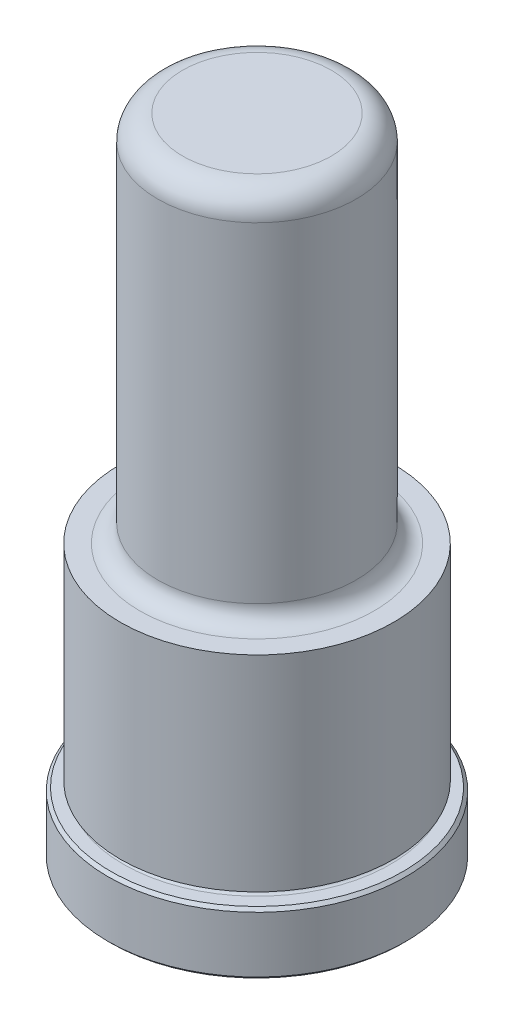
SolidWorks part; units mm, degrees
ref_plane "Front Plane" through (0, 0, 0) normal (0, 0, 1) x (1, 0, 0)
ref_plane "Top Plane" through (0, 0, 0) normal (0, 1, 0) x (1, 0, 0)
ref_plane "Right Plane" through (0, 0, 0) normal (1, 0, 0) x (0, 0, -1)
sketch "Sketch1" plane through (0, 0, 0) normal (1, 0, 0) x (0, 0, -1)
  line L0 (0, 0) -> (19.05, 0)
  line L1 (19.05, 0) -> (19.05, 7.9248)
  line L2 (19.05, 7.9248) -> (17.0688, 7.9248)
  line L3 (16.6878, 2.6782) -> (16.6878, 5.9795) construction
  line L4 (17.0688, 8.6868) -> (17.4752, 8.6868)
  line L5 (17.4752, 8.6868) -> (17.4752, 34.925)
  line L6 (17.4752, 34.925) -> (14.9733, 34.925)
  line L7 (12.6873, 37.211) -> (12.6873, 82.55)
  line L9 (12.6873, 82.55) -> (0, 82.55)
  line L10 (0, 82.55) -> (0, 0)
  line L11 (0, 0) -> (0, -7.2694) construction
  arc A0 (17.0688, 8.6868) -> (17.0688, 7.9248) centre (17.0688, 8.3058) ccw
  arc A1 (14.9733, 34.925) -> (12.6873, 37.211) centre (14.9733, 37.211) cw
  point P2 (12.6873, 82.55)
  point P14 (12.6873, 82.4173)
  point P19 (12.6873, 34.925)
  dimension "D14" = 0.762
  dimension "D8" = 2.286
  dimension "T" = 7.9248
  dimension "D2" = 0.762
  dimension "M" = 38.1
  dimension "B" = 34.9504
  dimension "L" = 82.55
  dimension "D7" = 0.7874
  dimension "A" = 34.925
  dimension "D" = 25.3746
  dimension "D15" = 47.625
revolve "Revolve1" add sketch "Sketch1" angle 360 about L11
chamfer "Chamfer1" distance 0.381 angle 45 2 edges at (0, 0, 19.05) (0, 7.9248, 19.05)
fillet "Fillet7" radius 3.175 1 edges at (0, 82.55, 12.6873)
